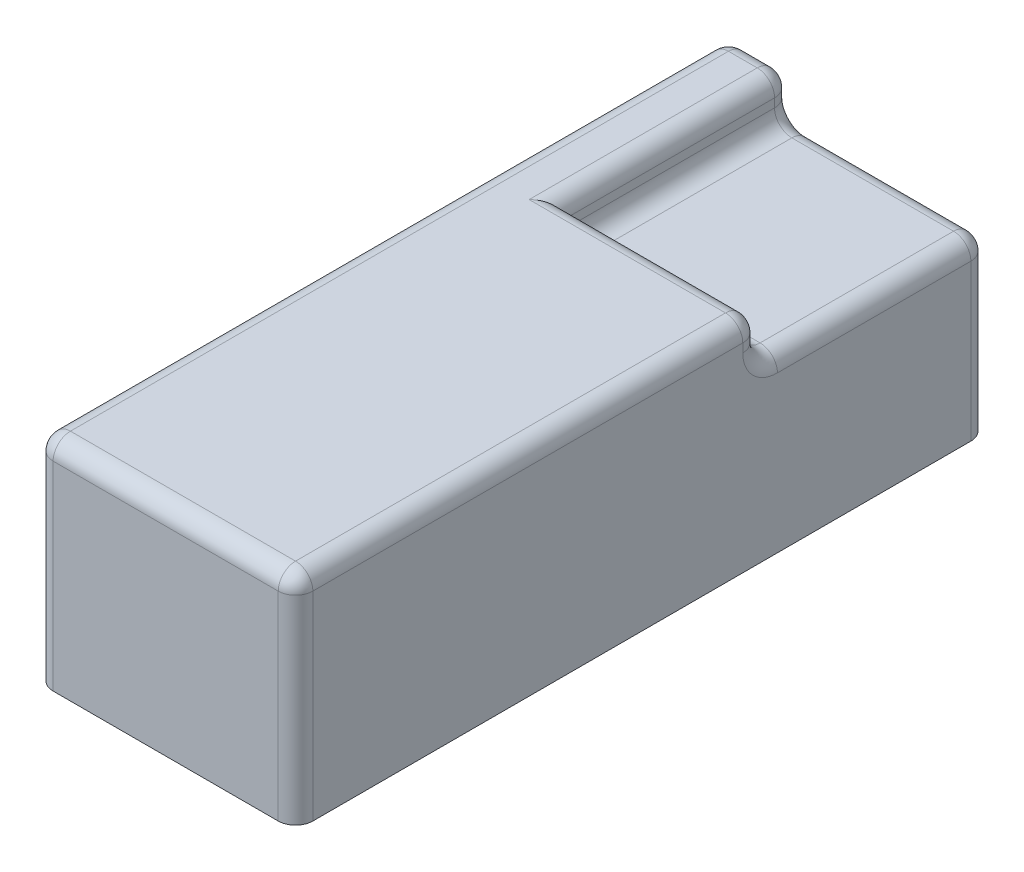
SolidWorks part; units mm, degrees
ref_plane "Front" through (0, 0, 0) normal (0, 0, 1) x (1, 0, 0)
ref_plane "Top" through (0, 0, 0) normal (0, 1, 0) x (1, 0, 0)
ref_plane "Right" through (0, 0, 0) normal (1, 0, 0) x (0, 0, -1)
sketch "Sketch1" plane through (0, 0, 0) normal (0, 1, 0) x (1, 0, 0)
  line L1 (0, 0) -> (30, 0)
  line L2 (0, 0) -> (0, 80)
  line L3 (0, 80) -> (30, 80)
  line L4 (30, 0) -> (30, 80)
  dimension "D1" = 80
  dimension "D2" = 30
extrude "Boss-Extrude1" add sketch "Sketch1" along normal blind 25
fillet "Fillet1" radius 2 8 edges at (15, 25, -80) (30, 25, -40) (15, 25, 0) (0, 25, -40) (30, 12.5, 0) (0, 12.5, 0) (30, 12.5, -80) (0, 12.5, -80)
sketch "Sketch2" plane through (0, 25, 0) normal (0, 1, 0) x (1, 0, 0)
  line L1 (7.3246, 85.3023) -> (34.8232, 85.3023)
  line L2 (7.3246, 85.3023) -> (7.3246, 53.6549)
  line L3 (7.3246, 53.6549) -> (34.8232, 53.6549)
  line L4 (34.8232, 85.3023) -> (34.8232, 53.6549)
extrude "Cut-Extrude1" cut sketch "Sketch2" against normal blind 5
fillet "Fillet2" radius 2 11 edges at (17.6623, 25, -53.6549) (7.3246, 25, -65.8275) (29.4142, 24.4142, -53.6549) (7.3246, 24.4142, -79.4142) (30, 21.5, -53.6549) (7.3246, 21.5, -80) (18.6623, 20, -53.6549) (7.3246, 20, -66.8275) (17.6623, 20, -80) (29.4142, 20, -79.4142) (30, 20, -65.8275)
sketch "Sketch3" plane through (0, 0, 0) normal (0, -1, 0) x (1, 0, 0)
  circle A0 centre (15, -71.6553) radius 4.4183
extrude "Boss-Extrude2" add sketch "Sketch3" along normal blind 1
